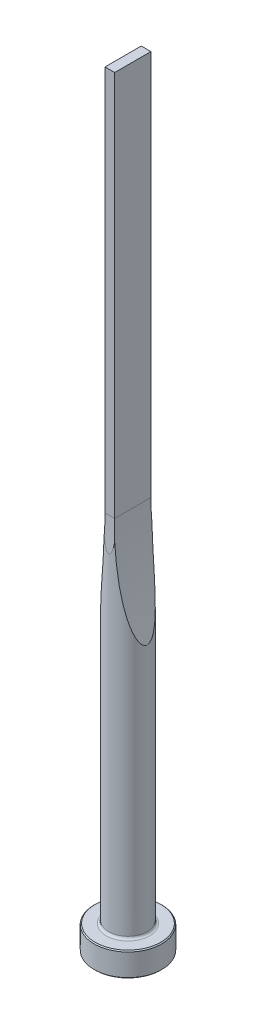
SolidWorks part; units mm, degrees
ref_plane "Front Plane" through (0, 0, 0) normal (0, 0, 1) x (1, 0, 0)
ref_plane "Top Plane" through (0, 0, 0) normal (0, 1, 0) x (1, 0, 0)
ref_plane "Right Plane" through (0, 0, 0) normal (1, 0, 0) x (0, 0, -1)
sketch "Sketch1" plane through (0, 0, 0) normal (0, 0, 1) x (1, 0, 0)
  line L0 (0, 0) -> (6.8, 0)
  line L1 (55, 0) -> (-55, 0) construction
  line L2 (7, 0.2) -> (7, 4.8)
  line L3 (6.8, 5) -> (4.5, 5)
  line L4 (4, 5.5) -> (4, 160)
  line L5 (0, 160) -> (4, 160)
  line L6 (7, 4.8) -> (6.8, 5)
  line L7 (6.8, 0) -> (7, 0.2)
  line L8 (0, 160) -> (0, 0)
  arc A0 (4, 5.5) -> (4.5, 5) centre (4.5, 5.5) ccw
  point P1 (7, 0)
  point P6 (7, 5)
  dimension "D4" = 0.5
  dimension "D1" = 4
  dimension "D2" = 7
  dimension "D3" = 5
  dimension "D5" = 160
revolve "Revolve1" add sketch "Sketch1" angle 360 about L8
sketch "Sketch2" plane through (0, 0, 0) normal (0, 0, 1) x (1, 0, 0)
  line L0 (1, 160) -> (1, 80)
  line L1 (4, 160) -> (-4, 160) construction
  line L2 (-1, 160) -> (-1, 80)
  line L3 (4, 160) -> (4, 56.9566)
  line L4 (-4, 160) -> (-4, 56.9566)
  line L5 (0, -7.7) -> (0, 7.7) construction
  line L6 (4, 160) -> (1, 160)
  line L8 (-1, 160) -> (-4, 160)
  arc A0 (1, 80) -> (4, 56.9566) centre (91, 80) ccw
  arc A1 (-1, 80) -> (-4, 56.9566) centre (-91, 80) cw
  dimension "D4" = 90
  dimension "D1" = 80
  dimension "D2" = 2
  dimension "D3" = 1
extrude "Cut-Extrude1" cut sketch "Sketch2" against normal mid plane 10
sketch "Sketch3" plane through (0, 0, 0) normal (1, 0, 0) x (0, 0, -1)
  line L0 (3.75, 160) -> (3.75, 80)
  line L1 (-3.873, 160) -> (3.873, 160) construction
  line L2 (-3.75, 160) -> (-3.75, 80)
  line L3 (4, 160) -> (4, 73.2965)
  line L4 (3.75, 160) -> (4, 160)
  line L5 (0, 7.7) -> (0, -7.7) construction
  line L6 (-4, 160) -> (-4, 73.2965)
  line L8 (-3.75, 160) -> (-4, 160)
  arc A0 (3.75, 80) -> (4, 73.2965) centre (93.75, 80) ccw
  arc A1 (-3.75, 80) -> (-4, 73.2965) centre (-93.75, 80) cw
  dimension "D2" = 90
  dimension "D1" = 80
  dimension "D3" = 7.5
  dimension "D4" = 3.75
extrude "Cut-Extrude2" cut sketch "Sketch3" against normal mid plane 10
